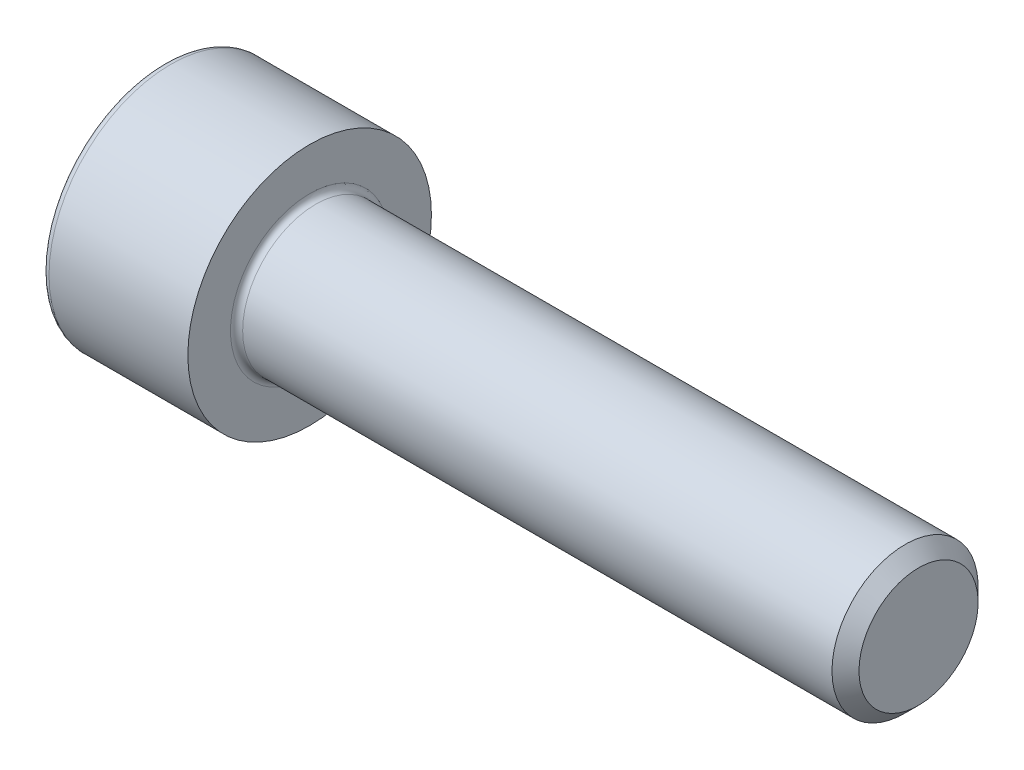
SolidWorks part; units mm, degrees
ref_plane "Plane1" through (0, 0, 0) normal (0, 0, 1) x (1, 0, 0)
ref_plane "Plane2" through (0, 0, 0) normal (0, 1, 0) x (1, 0, 0)
ref_plane "Plane3" through (0, 0, 0) normal (1, 0, 0) x (0, 0, -1)
revolve "Base-Revolve" add sketch "BodySke" angle 360 about L6
sketch "BodySke" plane through (0, 0, 0) normal (0, 0, 1) x (1, 0, 0)
  line L0 (0, 0) -> (0, 5)
  line L1 (0, 5) -> (6, 5)
  line L2 (6, 5) -> (6, 3)
  line L3 (6, 3) -> (30.4455, 3)
  line L4 (31, 2.4455) -> (31, 0)
  line L5 (31, 0) -> (0, 0)
  line L6 (-31.75, 0) -> (127, 0) construction
  line L8 (31, 2.4455) -> (30.4455, 3)
  line L10 (31, -2.4455) -> (30.4455, -3) construction
  line L11 (7, 9.525) -> (7, 3.175) construction
  line L12 (6, 9.525) -> (6, 3.175) construction
  line L13 (-29, 9.525) -> (-29, 3.175) construction
  dimension "Diameter" = 6
  dimension "Head_ht" = 6
  dimension "Length" = 25
  dimension "Body_ch_ang" = 45
  dimension "Head_dia" = 10
  dimension "Minor_dia" = 4.891
  dimension "Advance" = 1
  dimension "Thread_nom" = 25
  dimension "Thread_length" = 60
fillet "Fillet1" radius 0.25 1 edges at (6, 0, 3)
fillet "Fillet2" radius 0.3 1 edges at (0, 0, 5)
sketch "Sketch2" plane through (0, 0, 0) normal (0, 0, 1) x (1, 0, 0)
  line L0 (0, 2.542) -> (3, 2.542)
  line L1 (3, 2.542) -> (4.4676, 0)
  line L2 (-31.75, 0) -> (127, 0) construction
  line L3 (4.4676, 0) -> (0, 0)
  line L4 (0, 0) -> (0, 2.542)
  line L6 (0, 0) -> (47.625, 0) construction
  dimension "D1" = 2.542
  dimension "D2" = 60
  dimension "Depth" = 3
revolve "Hex-PreBroach" cut sketch "Sketch2" angle 360 about L6
sketch "Sketch3" plane through (0, 0, 0) normal (-1, 0, 0) x (0, 0.5, 0.866)
  line L0 (1.4676, 2.542) -> (-1.4676, 2.542)
  line L1 (-1.4676, 2.542) -> (-2.9352, 0)
  line L2 (1.4676, 2.542) -> (2.9352, 0)
  line L3 (1.4676, -2.542) -> (2.9352, 0)
  line L4 (1.4676, -2.542) -> (-1.4676, -2.542)
  line L5 (-1.4676, -2.542) -> (-2.9352, 0)
  dimension "D1" = 2.542
  dimension "D2" = 2.542
  dimension "Hex_size" = 5.084
extrude "Hex" cut sketch "Sketch3" against normal blind 3
sketch "ThdSchSke" plane through (0, 0, 0) normal (0, 0, 1) x (1, 0, 0)
  line L0 (9, -2.4455) -> (8.6117, -3)
  line L1 (9, -2.4455) -> (9.3883, -3)
  line L2 (9.3883, -3) -> (9.3883, -3.75)
  line L3 (-3.175, 0) -> (5.1513, 0) construction
  line L4 (0, 4.7) -> (0, -4.7) construction
  line L5 (9.3883, -3.75) -> (8.6117, -3.75)
  line L6 (8.6117, -3.75) -> (8.6117, -3)
  dimension "Thread_minor" = 4.891
  dimension "Diameter" = 6
  dimension "Start" = 9
  dimension "SideAngle" = 55
  dimension "VeeAngle" = 70
  dimension "Overcut" = 7.5
revolve "ThreadSchematic" [suppressed] cut sketch "ThdSchSke" angle 360 about L3
pattern_linear "ThdSchPat" [suppressed]
equation "\"D2@Sketch3\" = \"Hex_size@Sketch3\" / 2"
equation "\"D1@Sketch3\" = \"Hex_size@Sketch3\" / 2"
equation "\"D1@Sketch2\" = \"Hex_size@Sketch3\" / 2"
equation "\"Thread_minor@ThreadCosmetic\"  =  \"Minor_dia@BodySke\""
equation "\"Depth@Sketch2\" =  \"Key_eng@Hex\""
equation "\"Thread_length@ThreadCosmetic\" = ((sgn( (\"Length@BodySke\" - \"Advance@BodySke\" * 3.0) - \"Thread_nom@BodySke\" )-1)*( (\"Length@BodySke\" - \"Advance@BodySke\" * 3.0) - \"Thread_nom@BodySke\" ))/-2+ \"Thread_no"
equation "\"Thread_minor@ThdSchSke\" = \"Minor_dia@BodySke\""
equation "\"Diameter@ThdSchSke\" = \"Diameter@BodySke\""
equation "\"Overcut@ThdSchSke\" = \"Diameter@BodySke\" * 1.25"
equation "\"Start@ThdSchSke\" = \"Head_ht@BodySke\" + \"Length@BodySke\" - \"Thread_length@ThreadCosmetic\"  '---Non-countersunk---"
equation "\"Num_threads@ThdSchPat\" = int( \"Thread_length@ThreadCosmetic\" / \"Advance@BodySke\" + 0.999 )  + 1"
equation "\"Advance@ThdSchPat\" = \"Thread_length@ThreadCosmetic\" /  (\"Num_threads@ThdSchPat\" - 1) 'relax it"
equation "\"Num_threads@ThdSchPat\" = \"Num_threads@ThdSchPat\" - sgn( \"Num_threads@ThdSchPat\" - 1) '---chamfered tips only---"
